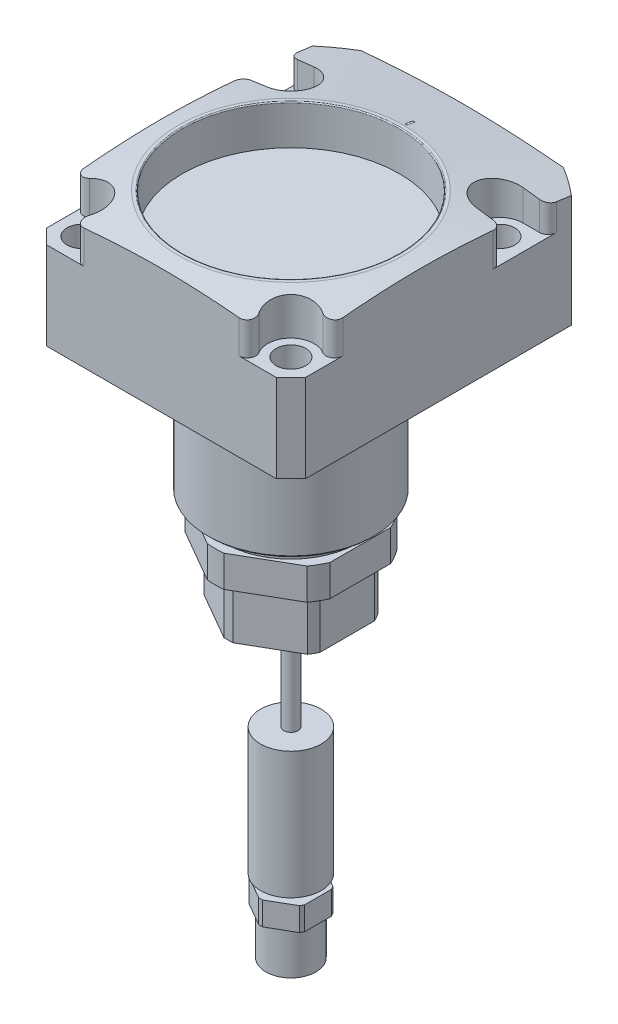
SolidWorks part; units mm, degrees
ref_plane "Front Plane" through (0, 0, 0) normal (0, 0, 1) x (1, 0, 0)
ref_plane "Top Plane" through (0, 0, 0) normal (0, 1, 0) x (1, 0, 0)
ref_plane "Right Plane" through (0, 0, 0) normal (1, 0, 0) x (0, 0, -1)
sketch "Sketch6" plane through (0, 0, 0) normal (0, 0, 1) x (1, 0, 0)
  line L0 (0, -8.9689) -> (0, 71.3762) construction
  line L1 (26.0096, 30.5562) -> (27, 30.5562)
  line L2 (27, 30.5562) -> (47.625, 26.9195)
  line L3 (47.625, 26.9195) -> (47.625, 0)
  line L4 (47.625, 0) -> (19.885, 0)
  line L5 (19.885, 0) -> (19.885, -31.6992)
  line L6 (19.885, -31.6992) -> (0, -31.6992)
  line L7 (0, -31.6992) -> (0, 21.0058)
  line L8 (26.0096, 30.5562) -> (26.0096, 21.0058)
  line L9 (26.0096, 21.0058) -> (0, 21.0058)
  dimension "D1" = 39.77
  dimension "D2" = 30.5562
  dimension "D3" = 31.6992
  dimension "D4" = 95.25
  dimension "D5" = 10
  dimension "D6" = 54
  dimension "D7" = 9.5504
  dimension "D8" = 52.0192
  dimension "D9" = 62.2554
  dimension "D10" = 3.6367
revolve "Revolve3" add sketch "Sketch6" angle 360 about L0
fillet "Fillet7" radius 0.254 1 edges at (0, 30.5562, -26.0096)
sketch "Sketch7" plane through (0, 0, 0) normal (0, -1, 0) x (1, 0, 0)
  line L0 (0, 0) -> (0, -52.3237) construction
  line L1 (-30.9944, 30.9944) -> (30.9943, 30.9944)
  line L2 (-30.9944, 30.9944) -> (-30.9944, -41.0146)
  line L3 (-30.9944, -41.0146) -> (30.9944, -41.0146)
  line L4 (30.9943, 30.9944) -> (30.9944, -41.0146)
extrude "Cut-Extrude5" cut sketch "Sketch7" against normal through all flip side to cut
sketch "Sketch8" plane through (0, 0, 0) normal (0, -1, 0) x (1, 0, 0)
  circle A0 centre (-25.019, 25.019) radius 3.5687
extrude "Cut-Extrude6" cut sketch "Sketch8" against normal through all
pattern_circular "CirPattern2" count 4 over 360 about axis through (0, 0, 0) along (0, 1, 0) of "Cut-Extrude6"
chamfer "Chamfer1" distance 3.5052 angle 45 2 edges at (-30.9944, 13.7941, 30.9944) (30.9943, 13.7941, 30.9944)
sketch "Sketch9" plane through (0, 30.5562, 0) normal (0, 1, 0) x (1, 0, 0)
  line L0 (-30.9944, -27.4891) -> (-27.4892, -30.9944) construction
  line L1 (-27.4892, -30.9944) -> (27.4891, -30.9944) construction
  line L2 (30.9944, 30.5816) -> (30.9944, 19.4564)
  line L3 (-30.9944, -27.4891) -> (-27.4892, -30.9944)
  line L4 (30.9944, 19.4564) -> (25.019, 19.4564)
  line L5 (25.019, 30.5816) -> (30.9944, 30.5816)
  line L6 (-25.019, 30.5816) -> (-30.9944, 30.5816)
  line L7 (-30.9944, 36.1592) -> (-30.9944, -27.4891) construction
  line L8 (-30.9944, 19.4564) -> (-25.019, 19.4564)
  line L9 (-30.9944, 30.5816) -> (-30.9944, 19.4564)
  line L10 (-27.4892, -30.9944) -> (-23.1276, -30.9944)
  line L11 (0, 0) -> (0, 26.6366) construction
  line L13 (-30.9944, -23.1276) -> (-28.9524, -21.0856)
  line L14 (-21.0856, -28.9524) -> (-23.1276, -30.9944)
  line L15 (-30.9944, -23.1276) -> (-30.9944, -27.4891)
  line L16 (30.9944, -23.1276) -> (30.9944, -27.4891)
  line L17 (21.0856, -28.9524) -> (23.1276, -30.9944)
  line L18 (30.9944, -23.1276) -> (28.9524, -21.0856)
  line L19 (27.4891, -30.9944) -> (23.1276, -30.9944)
  line L20 (30.9944, -27.4891) -> (27.4891, -30.9944)
  arc A0 (-21.0856, -28.9524) -> (-28.9524, -21.0856) centre (-25.019, -25.019) ccw
  arc A1 (-25.019, 19.4564) -> (-25.019, 30.5816) centre (-25.019, 25.019) ccw
  arc A2 (21.0856, -28.9524) -> (28.9524, -21.0856) centre (25.019, -25.019) cw
  arc A3 (25.019, 19.4564) -> (25.019, 30.5816) centre (25.019, 25.019) cw
  dimension "D1" = 11.1252
extrude "Cut-Extrude7" cut sketch "Sketch9" against normal offset from surface (9.5504 mm away) 21.0058
fillet "Fillet4" radius 2.0066 8 edges at (-30.9944, 24.9351, -19.4564) (30.9944, 24.3226, -30.5816) (30.9944, 24.9351, -19.4564) (30.9944, 24.7519, 23.1276) (23.1276, 24.7519, 30.9944) (-23.1276, 24.7519, 30.9944) (-30.9944, 24.7519, 23.1276) (-30.9944, 24.3226, -30.5816)
fillet "Fillet5" radius 0.4013 1 edges at (0, 0, -19.885)
chamfer "Chamfer2" distance 0.5004 angle 45 1 edges at (0, -31.6992, -19.885)
ref_plane "Plane1" through (0, 17.018, 0) normal (0, -1, 0) x (1, 0, 0)
sketch "Sketch11" plane through (0, 17.018, 0) normal (0, -1, 0) x (1, 0, 0)
  line L0 (-14, -4.7006) -> (-14, -58.3255) construction
  line L1 (-24.2062, -41.0146) -> (24.2062, -41.0146) construction
  line L2 (-20.1849, -40.7646) -> (-19.6396, -38.1992)
  line L3 (-19.6396, -38.1992) -> (-18.9784, -37.538)
  line L10 (-14, -41.0146) -> (-24.4775, -41.0146)
  line L11 (-14, -26.0326) -> (-14, -41.0146)
  line L12 (-18.9784, -26.0326) -> (-14, -26.0326)
  line L13 (-18.9784, -37.538) -> (-18.9784, -26.0326)
  line L15 (-24.4775, -40.7646) -> (-20.1849, -40.7646)
  line L16 (-24.4775, -41.0146) -> (-24.4775, -40.7646)
  dimension "D1" = 14
  dimension "D2" = 0.25
  dimension "D3" = 14.732
  dimension "D4" = 9.9568
  dimension "D5" = 20.955
  dimension "D6" = 12
  dimension "D7" = 45
  dimension "D8" = 2.5654
  dimension "D9" = 12.3698
revolve "Cut-Revolve5" cut sketch "Sketch11" angle 360 about L0
ref_plane "Plane2" through (0, 0, -32.7406) normal (0, 0, 1) x (1, 0, 0)
sketch "Sketch13" plane through (0, 0, -32.7406) normal (0, 0, 1) x (1, 0, 0)
  line L0 (-17.4544, 17.7546) -> (-17.4544, 5.5009)
  line L1 (-18.572, 2.7432) -> (-18.1293, 4.826)
  line L2 (-18.572, 2.7432) -> (-19.4991, 2.7432)
  line L3 (-19.4991, 2.7432) -> (-19.4991, 0)
  line L4 (-20.2863, 0) -> (20.2863, 0) construction
  line L5 (-19.4991, 0) -> (-14, 0)
  line L6 (-14, 0) -> (-14, 17.7546)
  line L7 (-14, 17.7546) -> (-17.4544, 17.7546)
  line L8 (-14, 15.2099) -> (-14, -4.3918) construction
  line L9 (-18.1293, 4.826) -> (-17.4544, 5.5009)
  line L10 (-18.572, 2.7432) -> (-14, 2.7432) construction
  dimension "D1" = 14
  dimension "D2" = 6.9088
  dimension "D3" = 15.0114
  dimension "D4" = 2.7432
  dimension "D5" = 10.9982
  dimension "D6" = 2.0828
  dimension "D7" = 12
  dimension "D8" = 45
  dimension "D9" = 9.144
revolve "Cut-Revolve6" cut sketch "Sketch13" angle 360 about L8
sketch "Sketch1" plane through (-3.5242, 5.6324, -32.7406) normal (0, 0, 1) x (1, 0, 0)
  line L0 (-10.4758, 0) -> (-10.4758, 50000) construction
  line L1 (-8.8883, 2.521) -> (-6.6023, 2.521)
  line L2 (-6.6023, 2.521) -> (-6.6023, -0.3754)
  line L3 (-6.5642, -2.8892) -> (50000, -2.8892) construction
  line L4 (-7.4786, -1.289) -> (-7.4786, -1.9748)
  line L5 (-6.5642, -2.8892) -> (-5.0148, -2.8892)
  line L6 (-5.0148, -2.8892) -> (-5.0148, -4.3116)
  line L7 (-5.0148, -4.3116) -> (-5.6928, -4.3116)
  line L8 (-7.8088, -4.3116) -> (-7.8088, -5.4292)
  line L9 (-7.8088, -5.4292) -> (-8.8883, -5.4292)
  line L10 (-8.8883, -5.4292) -> (-8.8883, 2.521)
  line L11 (-1000, -2.8892) -> (-8.8883, -2.8892) construction
  line L12 (-6.1147, -4.3116) -> (-7.8088, -4.3116)
  arc A0 (-6.6023, -0.3754) -> (-7.4786, -1.289) centre (-6.5642, -1.289) ccw
  arc A1 (-7.4786, -1.9748) -> (-6.5642, -2.8892) centre (-6.5642, -1.9748) ccw
  arc A2 (-6.1147, -4.3116) -> (-5.6928, -4.3116) centre (-5.9038, -5.1752) ccw
  dimension "D8" = 1.6002
  dimension "D9" = 0.9144
  dimension "D10" = 7.9502
  dimension "D11" = 1.778
  dimension "D1" = 7.747
  dimension "D2" = 5.9944
  dimension "D3" = 10.922
  dimension "D4" = 5.334
  dimension "D5" = 3.175
  dimension "D6" = 1.4224
  dimension "D7" = 2.54
  dimension "D12" = 0.8636
revolve "Revolve1" add sketch "Sketch1" angle 360 about L0
sketch "Sketch2" plane through (-14, 0.2032, -32.7406) normal (0, -1, 0) x (0, 0, 1)
  line L0 (0, 0) -> (0, 50000) construction
  line L1 (0, 1.8331) -> (1.5875, 0.9165)
  line L2 (1.5875, 0.9165) -> (1.5875, -0.9165)
  line L3 (1.5875, -0.9165) -> (0, -1.8331)
  line L4 (0, -1.8331) -> (-1.5875, -0.9165)
  line L5 (-1.5875, -0.9165) -> (-1.5875, 0.9165)
  line L6 (-1.5875, 0.9165) -> (0, 1.8331)
  circle A0 centre (0, 0) radius 1.5875 construction
  dimension "D1" = 3.175
extrude "Cut-Extrude1" cut sketch "Sketch2" against normal up to surface (7.9502 mm away)
other "PORT_ADTAPTER<1>"
mirror "Mirror4" about plane through (0, 0, 0) normal (1, 0, 0) of "Revolve1", "Cut-Extrude1", "Cut-Revolve6", "Cut-Revolve5"
sketch "Sketch17" plane through (0, 0, 0) normal (1, 0, 0) x (0, 0, -1)
  line L0 (26.7557, 31.371) -> (29.9871, 30.8012) construction
  line L1 (41.0146, 28.085) -> (27, 30.5562) construction
  line L2 (27.5003, 30.468) -> (29.4764, 30.1195) construction
  line L3 (27.8786, 31.173) -> (29.3621, 30.9114) construction
  line L5 (27.7396, 30.3851) -> (29.2231, 30.1235)
  line L6 (27.0906, 31.3119) -> (30.15, 30.7725)
  arc A0 (27.0906, 31.3119) -> (27.7396, 30.3851) centre (27.8786, 31.173) ccw
  arc A1 (29.2231, 30.1235) -> (30.15, 30.7725) centre (29.3621, 30.9114) ccw
  dimension "D2" = 1.6002
  dimension "D1" = 0.76
  dimension "D3" = 2.0066
  dimension "D4" = 0.508
revolve "Cut-Revolve7" cut sketch "Sketch17" angle 360 about L0
sketch "Sketch18" plane through (0, -31.6992, 0) normal (0, -1, 0) x (1, 0, 0)
  circle A0 centre (0, 0) radius 15.9258
  dimension "D1" = 31.8516
extrude "Boss-Extrude1" add sketch "Sketch18" along normal blind 2.9718
sketch "Sketch19" plane through (0, -34.671, 0) normal (0, -1, 0) x (1, 0, 0)
  line L1 (2.0037, -18.0246) -> (14.6079, -10.7476)
  line L2 (16.6116, -7.277) -> (16.6116, 7.277)
  line L3 (14.6079, 10.7476) -> (2.0037, 18.0246)
  line L4 (-2.0037, 18.0246) -> (-14.6079, 10.7476)
  line L5 (-16.6116, 7.277) -> (-16.6116, -7.277)
  line L6 (-14.6079, -10.7476) -> (-2.0037, -18.0246)
  circle A0 centre (0, 0) radius 16.6116 construction
  arc A1 (2.0037, 18.0246) -> (-2.0037, 18.0246) centre (0, 0) ccw
  arc A2 (-14.6079, 10.7476) -> (-16.6116, 7.277) centre (0, 0) ccw
  arc A3 (-16.6116, -7.277) -> (-14.6079, -10.7476) centre (0, 0) ccw
  arc A4 (-2.0037, -18.0246) -> (2.0037, -18.0246) centre (0, 0) ccw
  arc A5 (14.6079, -10.7476) -> (16.6116, -7.277) centre (0, 0) ccw
  arc A6 (16.6116, 7.277) -> (14.6079, 10.7476) centre (0, 0) ccw
  dimension "D2" = 36.2712
  dimension "D1" = 33.2232
extrude "Boss-Extrude2" add sketch "Sketch19" along normal blind 7.5184
sketch "Sketch20" plane through (0, -42.1894, 0) normal (0, -1, 0) x (1, 0, 0)
  line L1 (13.5001, -6.5352) -> (13.5001, 6.5352)
  line L2 (12.4097, 8.4239) -> (1.0904, 14.959)
  line L3 (-1.0904, 14.959) -> (-12.4097, 8.4239)
  line L4 (-13.5001, 6.5352) -> (-13.5001, -6.5352)
  line L5 (-12.4097, -8.4239) -> (-1.0904, -14.959)
  line L6 (1.0904, -14.959) -> (12.4097, -8.4239)
  circle A0 centre (0, 0) radius 13.5001 construction
  arc A1 (1.0904, 14.959) -> (-1.0904, 14.959) centre (0, 0) ccw
  arc A2 (13.5001, 6.5352) -> (12.4097, 8.4239) centre (0, 0) ccw
  arc A3 (12.4097, -8.4239) -> (13.5001, -6.5352) centre (0, 0) ccw
  arc A4 (-1.0904, -14.959) -> (1.0904, -14.959) centre (0, 0) ccw
  arc A5 (-13.5001, -6.5352) -> (-12.4097, -8.4239) centre (0, 0) ccw
  arc A6 (-12.4097, 8.4239) -> (-13.5001, 6.5352) centre (0, 0) ccw
  dimension "D2" = 29.9974
  dimension "D1" = 27.0002
extrude "Boss-Extrude3" add sketch "Sketch20" along normal blind 13.0556
sketch "Sketch21" plane through (0, -55.245, 0) normal (0, -1, 0) x (1, 0, 0)
  circle A0 centre (0, 0) radius 1.7018
  dimension "D1" = 3.4036
extrude "Boss-Extrude4" add sketch "Sketch21" along normal blind 25.4
sketch "Sketch23" plane through (0, -80.645, 0) normal (0, -1, 0) x (1, 0, 0)
  circle A0 centre (0, 0) radius 7.2517
  dimension "D1" = 14.5034
extrude "Boss-Extrude5" add sketch "Sketch23" along normal blind 30.4038
sketch "Sketch25" plane through (0, -111.0488, 0) normal (0, -1, 0) x (1, 0, 0)
  circle A0 centre (0, 0) radius 4.2545
  dimension "D1" = 8.509
extrude "Boss-Extrude6" add sketch "Sketch25" along normal blind 1.7018
sketch "Sketch26" plane through (0, -112.7506, 0) normal (0, -1, 0) x (1, 0, 0)
  line L1 (-6.5024, 3.2103) -> (-6.5024, -3.2103)
  line L2 (-6.0314, -4.0261) -> (-0.471, -7.2364)
  line L3 (0.471, -7.2364) -> (6.0314, -4.0261)
  line L4 (6.5024, -3.2103) -> (6.5024, 3.2103)
  line L5 (6.0314, 4.0261) -> (0.471, 7.2364)
  line L6 (-0.471, 7.2364) -> (-6.0314, 4.0261)
  circle A0 centre (0, 0) radius 6.5024 construction
  arc A1 (-6.5024, -3.2103) -> (-6.0314, -4.0261) centre (0, 0) ccw
  arc A2 (-6.0314, 4.0261) -> (-6.5024, 3.2103) centre (0, 0) ccw
  arc A3 (0.471, 7.2364) -> (-0.471, 7.2364) centre (0, 0) ccw
  arc A4 (6.5024, 3.2103) -> (6.0314, 4.0261) centre (0, 0) ccw
  arc A5 (6.0314, -4.0261) -> (6.5024, -3.2103) centre (0, 0) ccw
  arc A6 (-0.471, -7.2364) -> (0.471, -7.2364) centre (0, 0) ccw
  dimension "D2" = 14.5034
  dimension "D1" = 13.0048
extrude "Boss-Extrude7" add sketch "Sketch26" along normal blind 5.588
sketch "Sketch27" plane through (0, -118.3386, 0) normal (0, -1, 0) x (1, 0, 0)
  circle A0 centre (0, 0) radius 5.9944
  dimension "D1" = 11.9888
extrude "Boss-Extrude8" add sketch "Sketch27" along normal blind 10.2108
equation "\"D3@Sketch8\"=\"D2@Sketch8\""
equation "\"D3@Sketch7\"=\"D4@Sketch7\""
